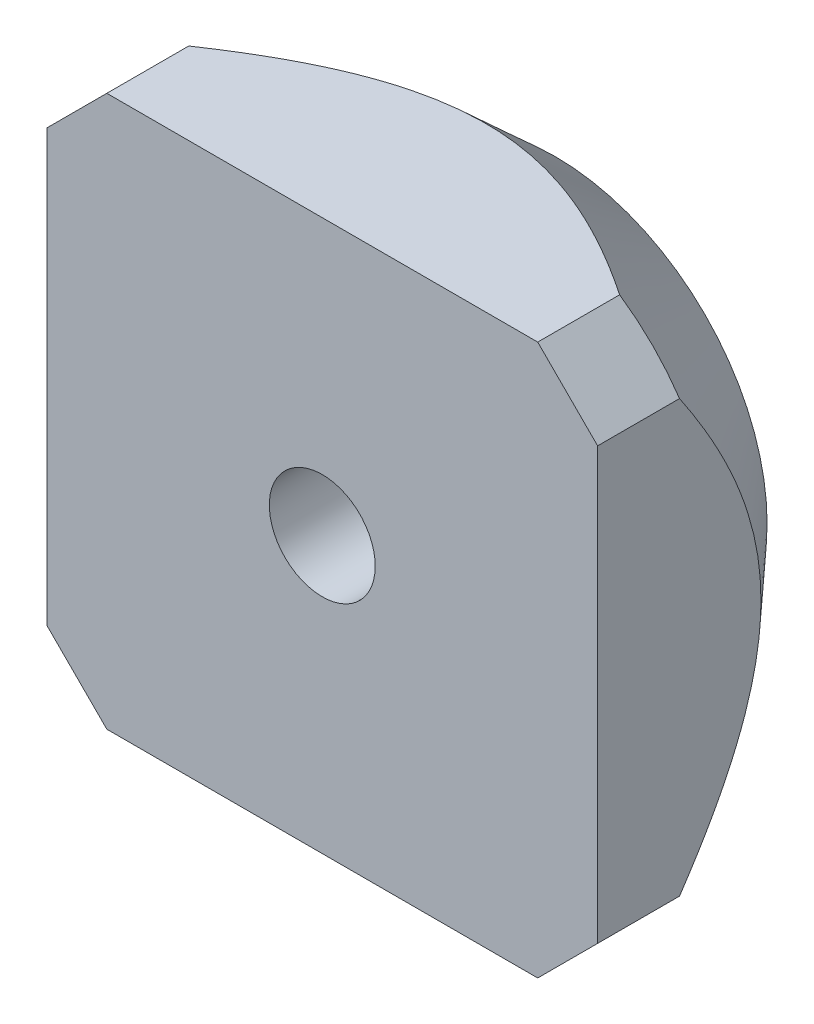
SolidWorks part; units mm, degrees
ref_plane "Front" through (0, 0, 0) normal (0, 0, 1) x (1, 0, 0)
ref_plane "Top" through (0, 0, 0) normal (0, 1, 0) x (1, 0, 0)
ref_plane "Right" through (0, 0, 0) normal (1, 0, 0) x (0, 0, -1)
imported_body "Imported1"
hole_wizard "M3x0.5 Tapped Hole1" positions "3DSketch1" profile "Sketch1" tap size "M3x0.5" standard "Ansi Metric"
sketch3d "3DSketch1"
  line L0 (-6.5, 5.0858, 0) -> (-6.5, -5.0858, 0) construction
  line L1 (5.0858, 6.5, 0) -> (-5.0858, 6.5, 0) construction
  point P0 (0, 0, 0)
  dimension "D1" = 6.5
  dimension "D2" = 6.5
sketch "Sketch1" plane through (0, 0, 0) normal (1, 0, 0) x (0, -1, 0)
  line L0 (0, 0) -> (0, 6.2511)
  line L1 (0, 6.2511) -> (1.25, 5.5)
  line L2 (1.25, 5.5) -> (1.25, 0)
  line L5 (1.25, 0) -> (0, 0)
  line L10 (0, 6.2511) -> (-1.25, 5.5) construction
  line L11 (0, -6.35) -> (0, 107.95) construction
  dimension "Tap Drill Dia." = 2.5
  dimension "Tap Drill Depth" = 5.5
  dimension "Drill Angle" = 118
